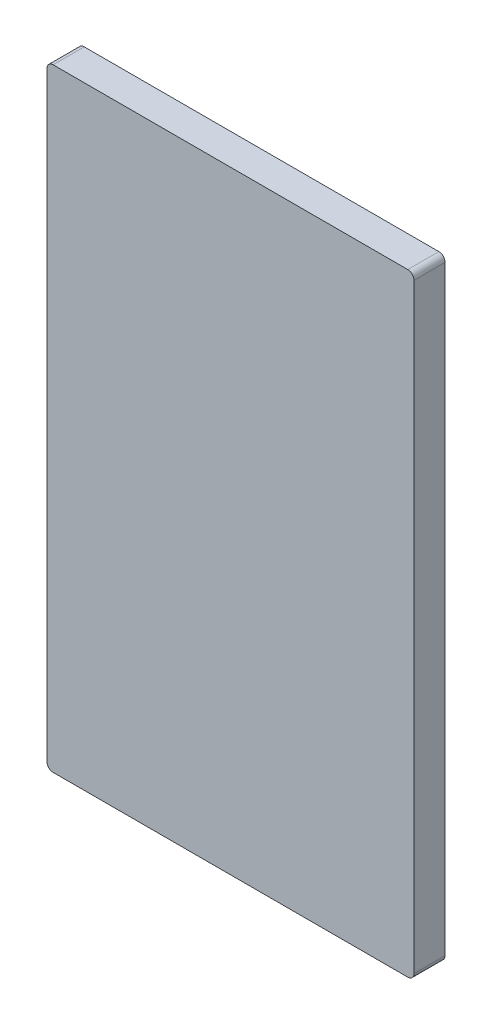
SolidWorks part; units mm, degrees
ref_plane "Plan de face" through (0, 0, 0) normal (0, 0, 1) x (1, 0, 0)
ref_plane "Plan de dessus" through (0, 0, 0) normal (0, 1, 0) x (1, 0, 0)
ref_plane "Plan de droite" through (0, 0, 0) normal (1, 0, 0) x (0, 0, -1)
sketch "Esquisse2" plane through (0, 0, 0) normal (0, 0, 1) x (1, 0, 0)
  line L1 (-71.565, 146.9056) -> (42.435, 146.9056)
  line L2 (-73.565, 144.9056) -> (-73.565, -48.0944)
  line L3 (-71.565, -50.0944) -> (42.435, -50.0944)
  line L4 (44.435, 144.9056) -> (44.435, -48.0944)
  arc A0 (-71.565, 146.9056) -> (-73.565, 144.9056) centre (-71.565, 144.9056) ccw
  arc A1 (42.435, 146.9056) -> (44.435, 144.9056) centre (42.435, 144.9056) cw
  arc A2 (42.435, -50.0944) -> (44.435, -48.0944) centre (42.435, -48.0944) ccw
  arc A3 (-73.565, -48.0944) -> (-71.565, -50.0944) centre (-71.565, -48.0944) ccw
  dimension "D3" = 2
  dimension "D1" = 118
  dimension "D2" = 197
extrude "Boss.-Extru.1" add sketch "Esquisse2" along normal blind 10
